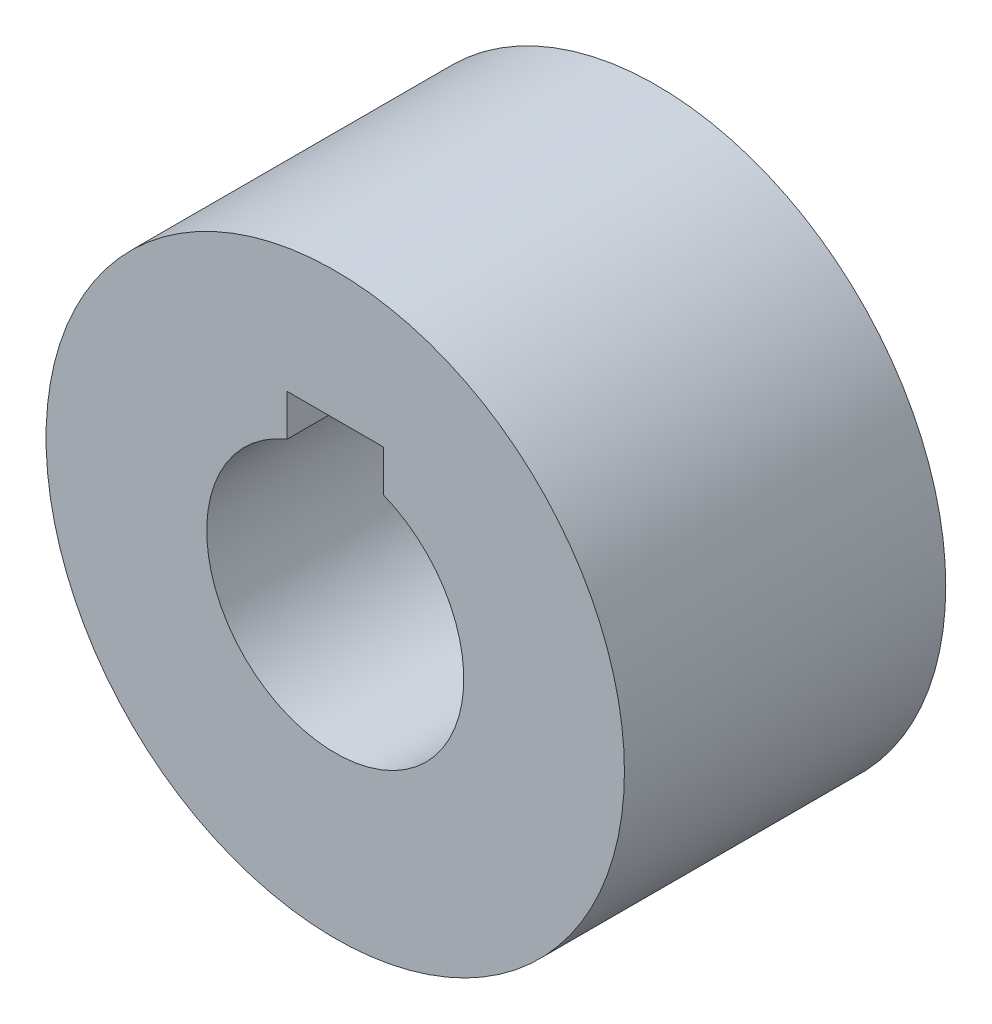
SolidWorks part; units mm, degrees
ref_plane "前视基准面" through (0, 0, 0) normal (0, 0, 1) x (1, 0, 0)
ref_plane "上视基准面" through (0, 0, 0) normal (0, 1, 0) x (1, 0, 0)
ref_plane "右视基准面" through (0, 0, 0) normal (1, 0, 0) x (0, 0, -1)
sketch "草图1" plane through (0, 0, 0) normal (0, 0, 1) x (1, 0, 0)
  line L0 (0, 11.715) -> (0, -12.6704) construction
  line L1 (-12.634, 0) -> (12.1078, 0) construction
  line L2 (-3, 7.4162) -> (-3, 10)
  line L3 (-3, 10) -> (3, 10)
  line L4 (3, 7.4162) -> (3, 10)
  arc A0 (-3, 7.4162) -> (3, 7.4162) centre (0, 0) ccw
  circle A1 centre (0, 0) radius 18
  point P13 (0, 10)
  dimension "D1" = 36
  dimension "D2" = 16
  dimension "D4" = 10
  dimension "D3" = 6
extrude "凸台-拉伸1" add sketch "草图1" along normal blind 20
ref_plane "基准面1" through (22, 0, 0) normal (1, 0, 0) x (0, 0, -1)
sketch "草图2" plane through (22, 0, 0) normal (1, 0, 0) x (0, 0, -1)
  line L0 (-24.8754, 0) -> (-6.9723, 0) construction
  line L1 (-12, 6.7466) -> (-12, -9.8402) construction
  line L2 (-20, 18) -> (-20, -18) construction
  line L3 (-12, 6) -> (-20, 6)
  line L4 (-12, -6) -> (-20, -6)
  line L5 (-20, 6) -> (-20, -6)
  arc A1 (-12, -6) -> (-12, 6) centre (-12, 0) ccw
  dimension "D1" = 6
  dimension "D3" = 8
sketch "草图3" plane through (22, 0, 0) normal (1, 0, 0) x (0, 0, -1)
  circle A0 centre (-12, 0) radius 2
  dimension "D1" = 4
